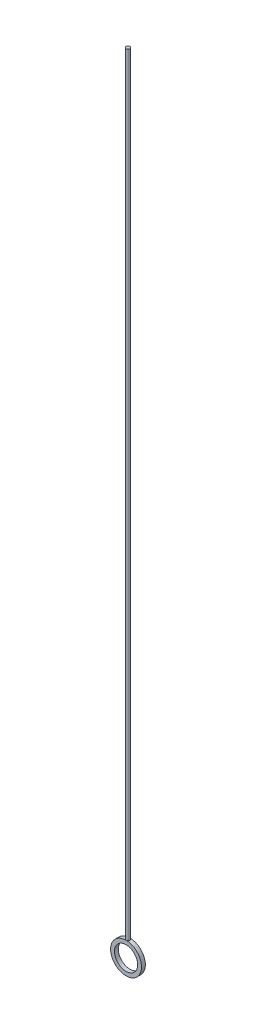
SolidWorks part; units mm, degrees
ref_plane "Front Plane" through (0, 0, 0) normal (0, 0, 1) x (1, 0, 0)
ref_plane "Top Plane" through (0, 0, 0) normal (0, 1, 0) x (1, 0, 0)
ref_plane "Right Plane" through (0, 0, 0) normal (1, 0, 0) x (0, 0, -1)
sketch "Sketch1" plane through (0, 0, 0) normal (0, 0, 1) x (1, 0, 0)
  circle A0 centre (0, 0) radius 4
  dimension "D1" = 8
extrude "Boss-Extrude1" add sketch "Sketch1" along normal blind 1
sketch "Sketch2" plane through (0, 0, 1) normal (0, 0, 1) x (1, 0, 0)
  circle A0 centre (0, 0) radius 3
  dimension "D1" = 6
extrude "Cut-Extrude1" cut sketch "Sketch2" against normal blind 2
ref_plane "Plane1" through (0, 4, 0) normal (0, 1, 0) x (1, 0, 0)
sketch "Sketch3" plane through (0, 4, 0) normal (0, 1, 0) x (1, 0, 0)
  line L0 (-4, -1) -> (4, -1) construction
  circle A0 centre (0, -0.5) radius 0.5
  point P2 (0, -0.3275)
  point P3 (0, -0.4588)
  dimension "D1" = 1
extrude "Boss-Extrude2" add sketch "Sketch3" along normal blind 200 separate body
